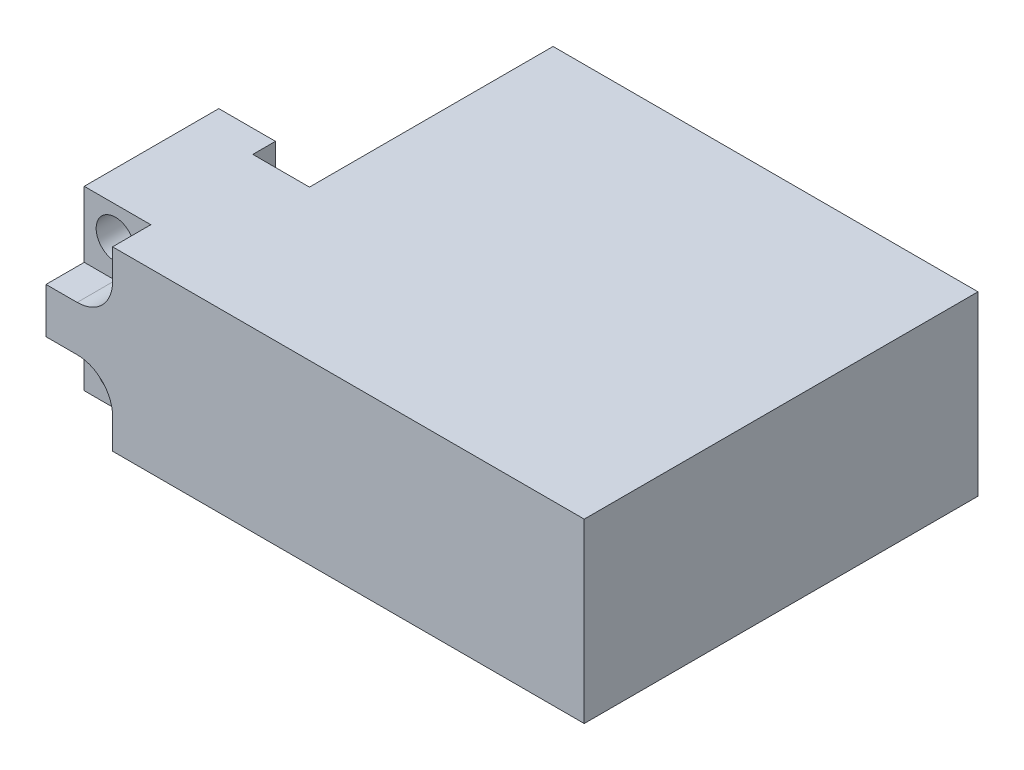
SolidWorks part; units mm, degrees
ref_plane "TOP" through (0, 0, 0) normal (0, 0, 1) x (1, 0, 0)
ref_plane "FRONT" through (0, 0, 0) normal (0, 1, 0) x (1, 0, 0)
ref_plane "RIGHT" through (0, 0, 0) normal (1, 0, 0) x (0, 0, -1)
sketch "Sketch1" plane through (0, 0, 0) normal (0, 1, 0) x (1, 0, 0)
  line L0 (-10.16, 15.494) -> (-10.16, 0)
  line L1 (-10.16, 15.494) -> (-5.08, 15.494)
  line L2 (-5.08, 15.494) -> (-5.08, 13.462)
  line L3 (-5.08, 13.462) -> (0, 13.462)
  line L4 (0, 13.462) -> (0, 35.306)
  line L5 (0, 35.306) -> (38.1, 35.306)
  line L6 (38.1, 35.306) -> (38.1, 0)
  line L7 (-10.16, 0) -> (38.1, 0)
  dimension "D1" = 21.844
  dimension "D2" = 5.08
  dimension "D3" = 5.08
  dimension "D4" = 35.306
  dimension "D5" = 2.032
  dimension "D6" = 38.1
  dimension "D7" = 48.26
extrude "Extrude1" add sketch "Sketch1" along normal mid plane 15.875
sketch "Sketch2" plane through (0, 0, 0) normal (0, 0, 1) x (1, 0, 0)
  line L0 (-10.16, 7.9375) -> (-10.16, -7.9375) construction
  point P0 (-7.366, 5.207)
  dimension "D1" = 2.794
  dimension "D2" = 5.207
hole_wizard "CBORE for #5 Socket Head Cap Screw1" positions "3DSketch1" profile "Sketch3" counterbore size "#5" standard "Ansi Inch"
sketch3d "3DSketch1"
  point P0 (-7.366, 5.207, 0)
sketch "Sketch3" plane through (-7.366, 5.207, 0) normal (1, 0, 0) x (0, -1, 0)
  line L0 (0, 0) -> (0, 35.306)
  line L1 (0, 35.306) -> (1.7272, 35.306)
  line L3 (1.7272, 35.306) -> (1.7272, 3.429)
  line L4 (1.7272, 3.429) -> (3.175, 3.429)
  line L5 (3.175, 3.429) -> (3.175, 0)
  line L7 (3.175, 0) -> (0, 0)
  line L11 (0, -6.35) -> (0, 107.95) construction
  dimension "Thru Hole Dia." = 3.4544
  dimension "Thru Hole Depth" = 35.306
  dimension "C'Bore Dia." = 6.35
  dimension "C'Bore Depth" = 3.429
sketch "Sketch4" plane through (0, 0, 0) normal (0, 0, 1) x (1, 0, 0)
  line L0 (-4.191, 5.207) -> (-4.191, 7.9375)
  line L2 (-5.7458, 7.9375) -> (38.1, 7.9375) construction
  line L3 (-4.191, 7.9375) -> (-10.16, 7.9375)
  line L4 (-10.16, 7.9375) -> (-10.16, 2.032)
  line L5 (-10.16, 3.699) -> (-10.16, -7.9375) construction
  line L6 (-10.16, 2.032) -> (-7.366, 2.032)
  arc A1 (-10.16, 3.699) -> (-5.7458, 7.9375) centre (-7.366, 5.207) ccw construction
  arc A4 (-10.16, 3.699) -> (-5.7458, 7.9375) centre (-7.366, 5.207) ccw construction
  arc A5 (-7.366, 2.032) -> (-4.191, 5.207) centre (-7.366, 5.207) ccw
extrude "Cut-Extrude2" cut sketch "Sketch4" against normal up to surface (3.429 mm away)
mirror "Mirror1" about plane through (0, 0, 0) normal (0, 1, 0) of "Cut-Extrude2", "CBORE for #5 Socket Head Cap Screw1"
